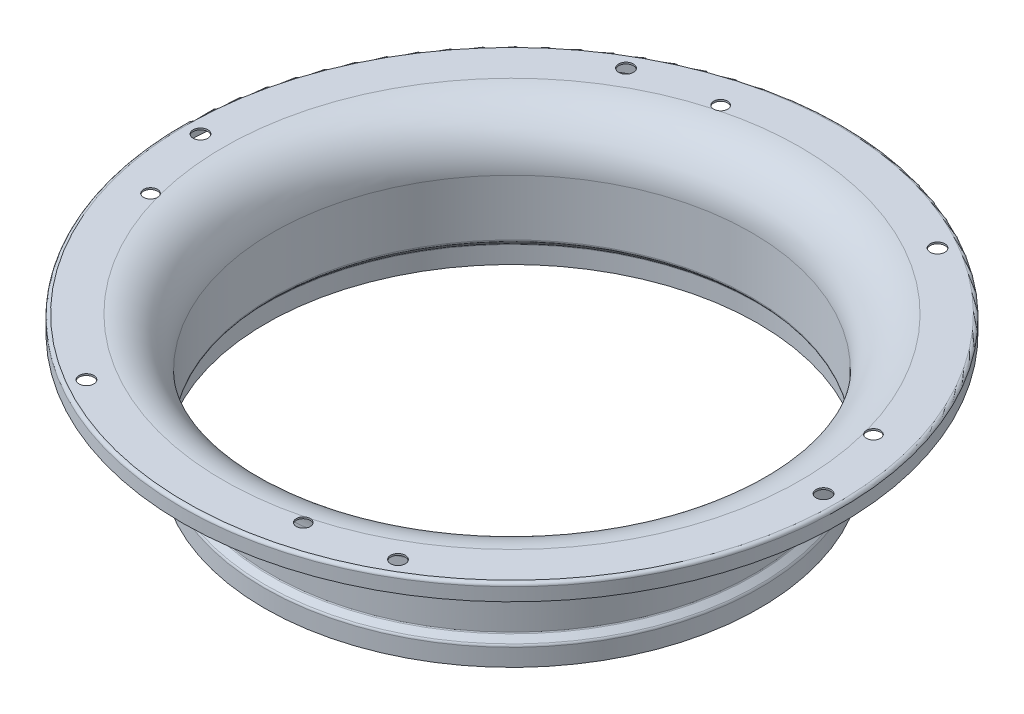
SolidWorks part; units mm, degrees
ref_plane "Plan de face" through (0, 0, 0) normal (0, 0, 1) x (1, 0, 0)
ref_plane "Plan de dessus" through (0, 0, 0) normal (0, 1, 0) x (1, 0, 0)
ref_plane "Plan de droite" through (0, 0, 0) normal (1, 0, 0) x (0, 0, -1)
sketch "Esquisse1" plane through (0, 0, 0) normal (0, 0, 1) x (1, 0, 0)
  line L0 (-150, 0) -> (-150, 10.5858)
  line L1 (-149.7071, 11.2929) -> (-146.5858, 14.4142)
  line L2 (-146, 15.8284) -> (-146, 50)
  line L3 (-176, 80) -> (-199, 80)
  line L4 (-201, 78) -> (-201, 70)
  line L5 (0, 0) -> (0, 130.4414) construction
  line L6 (-200, 78) -> (-200, 70)
  line L7 (-176, 79) -> (-199, 79)
  line L8 (-147, 15.8284) -> (-147, 50)
  line L9 (-150.4142, 12) -> (-147.2929, 15.1213)
  line L10 (-151, 0) -> (-151, 10.5858)
  line L11 (-150, 0) -> (-151, 0)
  line L12 (-201, 70) -> (-200, 70)
  arc A0 (-146, 50) -> (-176, 80) centre (-176, 50) ccw
  arc A1 (-147, 50) -> (-176, 79) centre (-176, 50) ccw
  arc A2 (-199, 79) -> (-200, 78) centre (-199, 78) ccw
  arc A3 (-147.2929, 15.1213) -> (-147, 15.8284) centre (-148, 15.8284) ccw
  arc A4 (-150, 10.5858) -> (-149.7071, 11.2929) centre (-149, 10.5858) cw
  arc A5 (-150.4142, 12) -> (-151, 10.5858) centre (-149, 10.5858) ccw
  arc A6 (-146, 15.8284) -> (-146.5858, 14.4142) centre (-148, 15.8284) cw
  arc A7 (-199, 80) -> (-201, 78) centre (-199, 78) ccw
  point P17 (-146, 80)
  point P26 (-150, 11)
  point P31 (-146, 15)
  point P34 (-201, 80)
  dimension "D9" = 30
  dimension "D10" = 29
  dimension "D11" = 1
  dimension "D12" = 2
  dimension "D1" = 11
  dimension "D2" = 4
  dimension "D3" = 4
  dimension "D4" = 80
  dimension "D5" = 55
  dimension "D6" = 10
  dimension "D7" = 150
  dimension "D8" = 1
revolve "Révolution1" add sketch "Esquisse1" angle 360 about L5
hole_wizard "Dégagement M61" positions "Esquisse3" profile "Esquisse2" hole size "M6" standard "ISO"
sketch "Esquisse3" plane through (0, 80, 0) normal (0, 1, 0) x (-1, 0, 0)
  point P3 (190, 0)
  dimension "D1" = 190
sketch "Esquisse2" plane through (-190, 80, 0) normal (1, 0, 0) x (0, 0, 1)
  line L0 (0, 0) -> (0, 62.7039)
  line L1 (0, 62.7039) -> (4.5, 60)
  line L2 (4.5, 60) -> (4.5, 0)
  line L5 (4.5, 0) -> (0, 0)
  line L10 (0, 62.7039) -> (-4.5, 60) construction
  line L11 (0, -6.35) -> (0, 107.95) construction
  dimension "Diamètre du perçage" = 9
  dimension "Profondeur du perçage" = 60
  dimension "Angle de pointe" = 118
pattern_circular "Répétition circulaire1" count 6 over 360 about axis through (0, 0, 0) along (0, 1, 0) of "Dégagement M61"
hole_wizard "Diamètre du perçage M8.5 (8.500000)1" positions "Esquisse5" profile "Esquisse4" hole size "M8.5" standard "ISO"
sketch "Esquisse5" plane through (0, 80, 0) normal (0, 1, 0) x (-1, 0, 0)
  line L0 (-95, 164.5448) -> (0, 0) construction
  line L1 (0, 0) -> (-46.5874, 173.8666) construction
  point P0 (-46.5874, 173.8666)
  dimension "D1" = 180
  dimension "D2" = 15
sketch "Esquisse4" plane through (46.5874, 80, 173.8666) normal (1, 0, 0) x (0, 0, 1)
  line L0 (0, 0) -> (0, 62.5537)
  line L1 (0, 62.5537) -> (4.25, 60)
  line L2 (4.25, 60) -> (4.25, 0)
  line L5 (4.25, 0) -> (0, 0)
  line L10 (0, 62.5537) -> (-4.25, 60) construction
  line L11 (0, -6.35) -> (0, 107.95) construction
  dimension "Diamètre du perçage" = 8.5
  dimension "Profondeur du perçage" = 60
  dimension "Angle de pointe" = 118
pattern_circular "Répétition circulaire2" count 4 over 360 about axis through (0, 0, 0) along (0, 1, 0) of "Diamètre du perçage M8.5 (8.500000)1"
